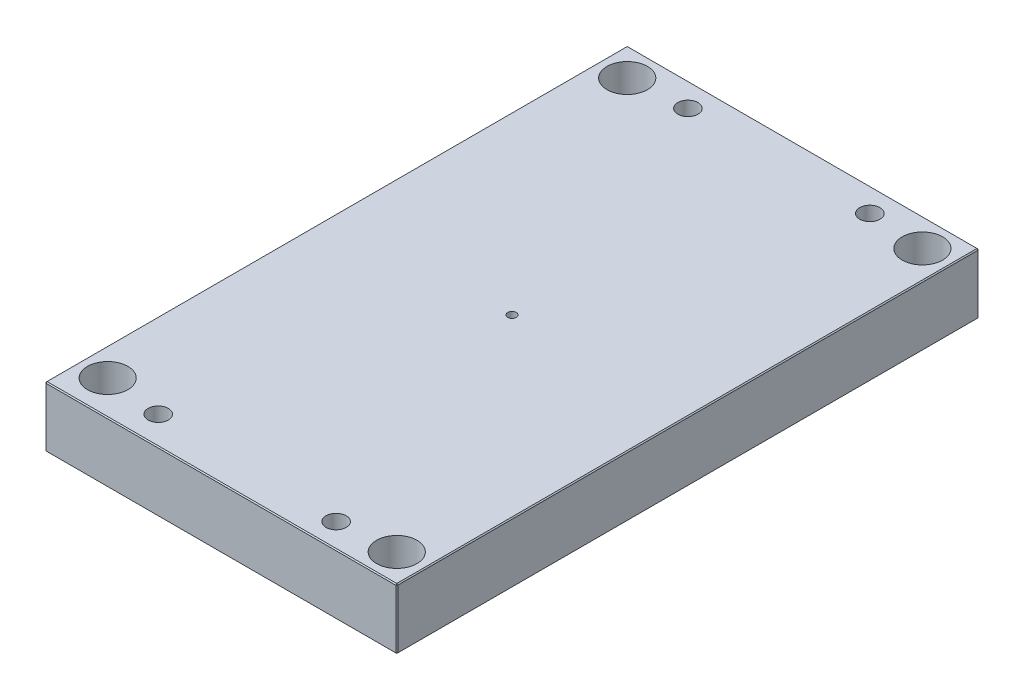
SolidWorks part; units mm, degrees
extrude "Base-Extrude" add sketch "Sketch1" along normal mid plane 457.2
sketch "Sketch1" plane through (0, 0, 0) normal (0, 0, 1) x (1, 0, 0)
  line L0 (-138.1125, 0) -> (138.1125, 0)
  line L1 (-138.1125, 0) -> (-138.1125, -47.625)
  line L2 (138.1125, -47.625) -> (-138.1125, -47.625)
  line L3 (138.1125, -47.625) -> (138.1125, 0)
  line L4 (50, 0) -> (-50, 0) construction
  dimension "halfW" = 138.1125
  dimension "W" = 276.225
  dimension "Thick" = 47.625
other "SB3" parameters "SBcbDia"=36.2585, "D1"=121.6028, "D2"=121.6028, "SB1Y"=206.375, "Diameter"=10.7137, "D3"=82.982, "D4"=82.341, "Depth"=38.1, "Drill Angle"=118, "RPdia"=15.875, "RP1Y"=209.55, "RPX"=71.4375, "RP3Y"=206.375, "TubeDia"=19.05, "sh1Y"=149.225, "shX"=113.5063, "shDia"=13.0962, "sh5Y"=25.4, "sh9Y"=50.8, "TapDepth"=82.55, "TapDia"=3.6398
sketch "SB3ctrl" plane through (-167.5414, 0, 167.5414) normal (0, 1, 0) x (-1, 0, 0)
  circle A0 centre (-51.6539, 34.0711) radius 15.8813
  dimension "SBdia" = 31.7627
  dimension "SBX" = 115.8875
  dimension "SB3Y" = 201.6125
ref_plane "Plane1" through (0, 0, 0) normal (0, 0, 1) x (1, 0, 0)
ref_plane "Plane2" through (0, 0, 0) normal (0, 1, 0) x (1, 0, 0)
ref_plane "Plane3" through (0, 0, 0) normal (1, 0, 0) x (0, 0, -1)
other "SprueHole"
sketch "Sprue" plane through (0, 0, 0) normal (0, 1, 0) x (-1, 0, 0)
  circle A0 centre (0, 0) radius 3.3734
  dimension "SPdia" = 6.7469
other "SB1"
sketch "SB1ctrl" plane through (0, 0, 0) normal (0, 1, 0) x (-1, 0, 0)
  circle A0 centre (-115.8875, -206.375) radius 15.8814
sketch "SB2ctrl" plane through (-7.7975, 0, 164.4517) normal (0, 1, 0) x (-1, 0, 0)
  circle A0 centre (-123.685, 41.9233) radius 15.8814
other "SB2"
sketch "SB4ctrl" plane through (-175.8091, 0, -3.5599) normal (0, 1, 0) x (-1, 0, 0)
  circle A0 centre (-59.9216, -202.8151) radius 15.8814
other "SB4"
other "RP1"
sketch "RP1ctrl" plane through (0, 0, 0) normal (0, 1, 0) x (-1, 0, 0)
  circle A0 centre (-71.4375, -209.55) radius 7.9375
sketch "RP2ctrl" plane through (-3.1102, 0, 111.0325) normal (0, 1, 0) x (-1, 0, 0)
  circle A0 centre (-74.5477, 98.5175) radius 7.9375
other "RP2"
sketch "RP3ctrl" plane through (-88.7572, 0, 117.352) normal (0, 1, 0) x (-1, 0, 0)
  circle A0 centre (-17.3197, 89.023) radius 7.9375
other "RP3"
sketch "RP4ctrl" plane through (-93.5338, 0, -10.6988) normal (0, 1, 0) x (-1, 0, 0)
  circle A0 centre (-22.0963, -198.8512) radius 7.9375
other "RP4"
chamfer "EdgeBreak" distance 0.7937 angle 45 12 edges at (138.1125, -23.8125, 228.6) (0, 0, 228.6) (-138.1125, -23.8125, 228.6) (0, 0, -228.6) (138.1125, -23.8125, -228.6) (0, -47.625, -228.6) (-138.1125, -23.8125, -228.6) (0, -47.625, 228.6) (-138.1125, 0, 0) (138.1125, 0, 0) (138.1125, -47.625, 0) (-138.1125, -47.625, 0)
other "SBcbore1" parameters "D1"=4.7625
sketch "sbcb1" plane through (0, -47.625, 0) normal (0, -1, 0) x (1, 0, 0)
  circle A0 centre (-115.8875, 201.6125) radius 18.1292
  circle A1 centre (-115.8875, 201.6125) radius 15.8814 construction
sketch "sbcb2" plane through (312.527, -47.625, -40.6474) normal (0, -1, 0) x (1, 0, 0)
  circle A0 centre (-196.6395, 247.0224) radius 18.1292
  circle A2 centre (-196.6395, 247.0224) radius 15.8814 construction
other "SBcbore2" parameters "D1"=4.7625
sketch "sbcb3" plane through (301.8018, -47.625, -471.4792) normal (0, -1, 0) x (1, 0, 0)
  circle A0 centre (-185.9143, 265.1042) radius 18.1292
  circle A2 centre (-185.9143, 265.1042) radius 15.8814 construction
other "SBcbore3" parameters "D1"=4.7625
sketch "sbcb4" plane through (31.6586, -47.625, -466.2862) normal (0, -1, 0) x (1, 0, 0)
  circle A0 centre (-147.5461, 259.9112) radius 18.1292
  circle A2 centre (-147.5461, 259.9112) radius 15.8814 construction
other "SBcbore4" parameters "D1"=4.7625
hole_wizard "Tap1" positions "Tap1ctrl" profile "Tap1rev"
sketch "Tap1ctrl" plane through (0, -47.625, 0) normal (0, -1, 0) x (1, 0, 0)
  point P0 (113.5062, -149.225)
sketch "Tap1rev" plane through (113.5062, -47.625, -149.225) normal (1, 0, 0) x (0, 0, -1)
  line L0 (0, 0) -> (0, 41.3187)
  line L1 (0, 41.3187) -> (5.3569, 38.1)
  line L2 (5.3569, 38.1) -> (5.3569, 0)
  line L4 (5.3569, 0) -> (0, 0)
  line L6 (0, 41.3187) -> (-5.3569, 38.1) construction
  line L7 (0, -4.2442) -> (0, 117.3081) construction
other "TubeBore1" parameters "D1"=6.35
sketch "TB1ctrl" plane through (0, -47.625, 0) normal (0, -1, 0) x (1, 0, 0)
  circle A0 centre (113.5062, -149.225) radius 9.525
  circle A1 centre (113.5062, -149.225) radius 5.3569 construction
hole_wizard "Tap2" positions "Tap2ctrl" profile "Tap2rev" legacy
sketch "Tap2ctrl" plane through (0, -47.625, 0) normal (0, -1, 0) x (1, 0, 0)
  point P0 (113.5063, 149.225)
sketch "Tap2rev" plane through (113.5063, -47.625, 149.225) normal (1, 0, 0) x (0, 0, -1)
  line L0 (0, 0) -> (0, 41.3187)
  line L1 (0, 41.3187) -> (5.3569, 38.1)
  line L2 (5.3569, 38.1) -> (5.3569, 0)
  line L4 (5.3569, 0) -> (0, 0)
  line L6 (0, 41.3187) -> (-5.3569, 38.1) construction
  line L7 (0, -4.2442) -> (0, 117.3081) construction
hole_wizard "Tap3" positions "Tap3ctrl" profile "Tap3rev"
sketch "Tap3ctrl" plane through (0, -47.625, 0) normal (0, -1, 0) x (1, 0, 0)
  point P0 (-113.5062, 149.225)
sketch "Tap3rev" plane through (-113.5062, -47.625, 149.225) normal (1, 0, 0) x (0, 0, -1)
  line L0 (0, 0) -> (0, 41.3187)
  line L1 (0, 41.3187) -> (5.3569, 38.1)
  line L2 (5.3569, 38.1) -> (5.3569, 0)
  line L4 (5.3569, 0) -> (0, 0)
  line L6 (0, 41.3187) -> (-5.3569, 38.1) construction
  line L7 (0, -4.2442) -> (0, 117.3081) construction
  dimension "Drill Angle" = 118
other "TubeBore3" parameters "D1"=6.35
sketch "Sketch3" plane through (-335.5406, -47.625, 392.9696) normal (0, -1, 0) x (1, 0, 0)
  circle A0 centre (222.0343, -243.7446) radius 9.525
  circle A1 centre (222.0343, -243.7446) radius 5.3569 construction
hole_wizard "Tap4" positions "Tap4ctrl" profile "Tap4rev" legacy
sketch "Tap4ctrl" plane through (0, -47.625, 0) normal (0, -1, 0) x (1, 0, 0)
  point P0 (-113.5063, -149.225)
sketch "Tap4rev" plane through (-113.5063, -47.625, -149.225) normal (1, 0, 0) x (0, 0, -1)
  line L0 (0, 0) -> (0, 41.3187)
  line L1 (0, 41.3187) -> (5.3569, 38.1)
  line L2 (5.3569, 38.1) -> (5.3569, 0)
  line L4 (5.3569, 0) -> (0, 0)
  line L6 (0, 41.3187) -> (-5.3569, 38.1) construction
  line L7 (0, -4.2442) -> (0, 117.3081) construction
  dimension "Drill Angle" = 118
hole_wizard "Tap5" positions "Tap5ctrl" profile "Tap5rev" legacy
sketch "Tap5ctrl" plane through (0, -47.625, 0) normal (0, -1, 0) x (1, 0, 0)
  point P0 (113.5063, 25.4)
sketch "Tap5rev" plane through (113.5063, -47.625, 25.4) normal (1, 0, 0) x (0, 0, -1)
  line L0 (0, 0) -> (0, 41.3187)
  line L1 (0, 41.3187) -> (5.3569, 38.1)
  line L2 (5.3569, 38.1) -> (5.3569, 0)
  line L4 (5.3569, 0) -> (0, 0)
  line L6 (0, 41.3187) -> (-5.3569, 38.1) construction
  line L7 (0, -4.2442) -> (0, 117.3081) construction
  dimension "Drill Angle" = 118
hole_wizard "Tap6" positions "Tap6ctrl" profile "Tap6rev" legacy
sketch "Tap6ctrl" plane through (0, -47.625, 0) normal (0, -1, 0) x (1, 0, 0)
  point P0 (-113.5063, -25.4)
sketch "Tap6rev" plane through (-113.5063, -47.625, -25.4) normal (1, 0, 0) x (0, 0, -1)
  line L0 (0, 0) -> (0, 41.3187)
  line L1 (0, 41.3187) -> (5.3569, 38.1)
  line L2 (5.3569, 38.1) -> (5.3569, 0)
  line L4 (5.3569, 0) -> (0, 0)
  line L6 (0, 41.3187) -> (-5.3569, 38.1) construction
  line L7 (0, -4.2442) -> (0, 117.3081) construction
  dimension "Drill Angle" = 118
equation "\"SBcbDia@sbcb1\" = \"SBdia@SB1ctrl\" + .177"
equation "\"Depth@Tap2rev\" = \"Depth@Tap1rev\""
equation "\"D1@Cosmetic Thread1\" = \"Depth@Tap1rev\" - \"D1@TubeBore1\""
equation "\"D1@Cosmetic Thread14\" = \"D1@Cosmetic Thread1\""
